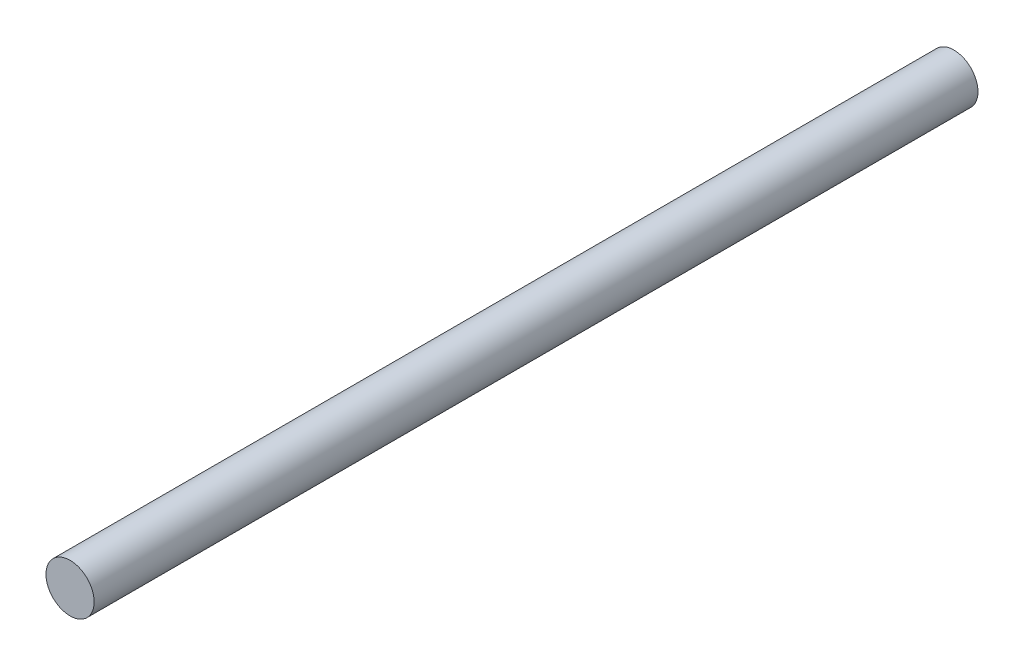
SolidWorks part; units mm, degrees
ref_plane "Front Plane" through (0, 0, 0) normal (0, 0, 1) x (1, 0, 0)
ref_plane "Top Plane" through (0, 0, 0) normal (0, 1, 0) x (1, 0, 0)
ref_plane "Right Plane" through (0, 0, 0) normal (1, 0, 0) x (0, 0, -1)
sketch "Sketch1" plane through (0, 0, 0) normal (0, 0, 1) x (1, 0, 0)
  circle A0 centre (0, 0) radius 30
  dimension "D1" = 60
extrude "Boss-Extrude1" add sketch "Sketch1" against normal blind 1100
